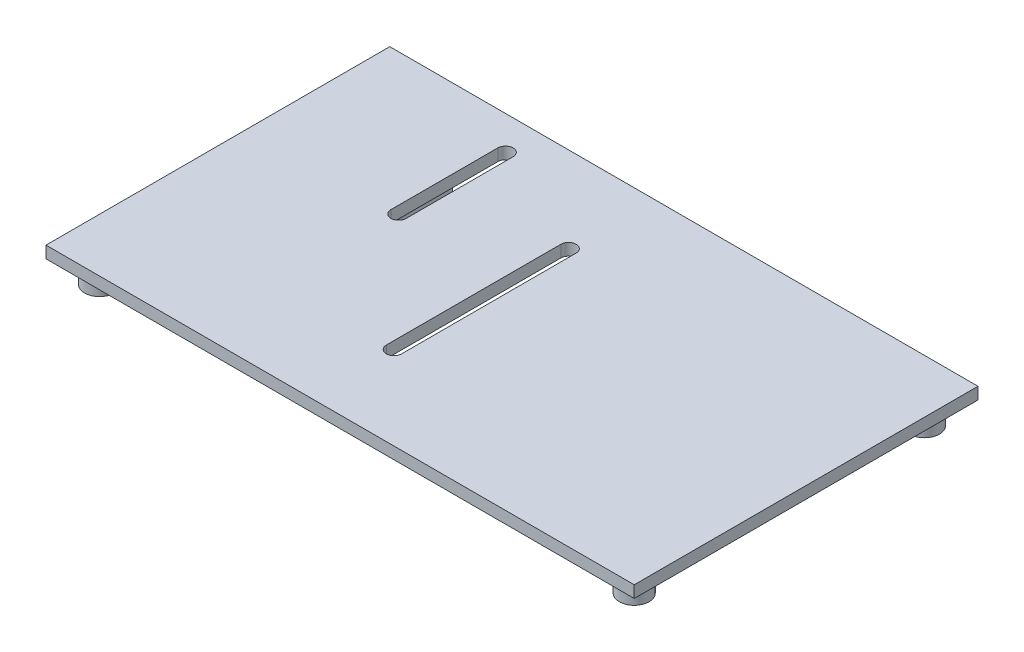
SolidWorks part; units mm, degrees
ref_plane "Front Plane" through (0, 0, 0) normal (0, 0, 1) x (1, 0, 0)
ref_plane "Top Plane" through (0, 0, 0) normal (0, 1, 0) x (1, 0, 0)
ref_plane "Right Plane" through (0, 0, 0) normal (1, 0, 0) x (0, 0, -1)
sketch "Sketch1" plane through (0, 0, 0) normal (0, 1, 0) x (1, 0, 0)
  line L1 (-38.5, -22.5) -> (38.5, -22.5)
  line L2 (-38.5, -22.5) -> (-38.5, 22.5)
  line L3 (-38.5, 22.5) -> (38.5, 22.5)
  line L4 (38.5, -22.5) -> (38.5, 22.5)
  line L5 (-38.5, -22.5) -> (38.5, 22.5) construction
  line L6 (-38.5, 22.5) -> (38.5, -22.5) construction
  point P0 (0, 0)
  dimension "D1" = 77
  dimension "D2" = 45
extrude "Base Extrude" add sketch "Sketch1" along normal blind 1.56
sketch "Sketch2" plane through (0, 0, 0) normal (0, -1, 0) x (1, 0, 0)
  line L1 (-35, 19) -> (35, 19) construction
  line L2 (-35, 19) -> (-35, -19) construction
  line L3 (-35, -19) -> (35, -19) construction
  line L4 (35, 19) -> (35, -19) construction
  line L5 (-35, 19) -> (35, -19) construction
  line L6 (-35, -19) -> (35, 19) construction
  circle A0 centre (-35, 19) radius 3
  circle A1 centre (35, 19) radius 3
  circle A2 centre (-35, -19) radius 3
  circle A3 centre (35, -19) radius 3
  point P8 (0, 0)
  dimension "D3" = 6
  dimension "D1" = 70
  dimension "D2" = 38
extrude "Standoff Extrude" add sketch "Sketch2" along normal blind 0.5
sketch "Sketch3" plane through (0, -0.5, 0) normal (0, -1, 0) x (1, 0, 0)
  circle A0 centre (-35, 19) radius 1.95
  circle A1 centre (-35, -19) radius 1.95
  circle A2 centre (35, -19) radius 1.95
  circle A3 centre (35, 19) radius 1.95
  dimension "D1" = 3.9
extrude "Standoff Extrude Two" add sketch "Sketch3" along normal blind 2.4
sketch "Sketch4" plane through (0, 0, 0) normal (0, -1, 0) x (1, 0, 0)
  line L0 (-38.5, 22.5) -> (38.5, 22.5) construction
  line L1 (-25, 13) -> (-20.3, 13)
  line L2 (-25, 13) -> (-25, -12.5)
  line L3 (-25, -12.5) -> (-20.3, -12.5)
  line L4 (-20.3, 13) -> (-20.3, -12.5)
  line L9 (12.25, -12.6) -> (17, -12.6)
  line L10 (12.25, -12.6) -> (12.25, -19.65)
  line L11 (12.25, -19.65) -> (17, -19.65)
  line L12 (17, -12.6) -> (17, -19.65)
  line L13 (-38.5, -22.5) -> (-38.5, 22.5) construction
  line L14 (38.5, -22.5) -> (-38.5, -22.5) construction
  line L15 (38.5, 22.5) -> (38.5, -22.5) construction
  dimension "D1" = 4.7
  dimension "D2" = 25.5
  dimension "D3" = 9.5
  dimension "D4" = 13.5
  dimension "D5" = 2.85
  dimension "D6" = 21.5
  dimension "D7" = 4.75
  dimension "D8" = 7.05
extrude "Touch and TFT ZIF" add sketch "Sketch4" along normal blind 1.25
sketch "Sketch5" plane through (0, 0, 0) normal (0, -1, 0) x (1, 0, 0)
  line L0 (-38.5, 22.5) -> (38.5, 22.5) construction
  line L1 (24, 9.75) -> (29.5, 9.75)
  line L2 (24, 9.75) -> (24, -9.75)
  line L3 (24, -9.75) -> (29.5, -9.75)
  line L4 (29.5, 9.75) -> (29.5, -9.75)
  line L5 (38.5, 22.5) -> (38.5, -22.5) construction
  dimension "D1" = 5.5
  dimension "D2" = 19.5
  dimension "D3" = 12.75
  dimension "D4" = 9
extrude "Interface ZIF" add sketch "Sketch5" along normal blind 2
sketch "Sketch6" plane through (0, 0, 0) normal (0, -1, 0) x (1, 0, 0)
  line L0 (-18.95, -4.1) -> (-18.95, -18.1) construction
  line L1 (-17.95, -4.1) -> (-17.95, -18.1)
  line L2 (-19.95, -4.1) -> (-19.95, -18.1)
  line L3 (-3.9, 11.55) -> (-3.9, -11.3) construction
  line L4 (-2.9, 11.55) -> (-2.9, -11.3)
  line L5 (-4.9, 11.55) -> (-4.9, -11.3)
  line L6 (-38.5, -22.5) -> (-38.5, 22.5) construction
  line L7 (38.5, -22.5) -> (-38.5, -22.5) construction
  arc A0 (-17.95, -4.1) -> (-19.95, -4.1) centre (-18.95, -4.1) ccw
  arc A1 (-19.95, -18.1) -> (-17.95, -18.1) centre (-18.95, -18.1) ccw
  arc A2 (-2.9, 11.55) -> (-4.9, 11.55) centre (-3.9, 11.55) ccw
  arc A3 (-4.9, -11.3) -> (-2.9, -11.3) centre (-3.9, -11.3) ccw
  point P2 (-18.95, -11.1)
  point P7 (-3.9, 0.125)
  dimension "D3" = 22.85
  dimension "D1" = 2
  dimension "D2" = 2
  dimension "D4" = 14
  dimension "D5" = 18.55
  dimension "D6" = 33.6
  dimension "D7" = 4.4
  dimension "D8" = 11.2
extrude "Cutout Cut" cut sketch "Sketch6" against normal through all
sketch "Sketch13" plane through (0, -2.9, 0) normal (0, -1, 0) x (1, 0, 0)
  circle A0 centre (-35, 19) radius 0.9
  circle A1 centre (35, 19) radius 0.9
  circle A2 centre (35, -19) radius 0.9
  circle A3 centre (-35, -19) radius 0.9
  dimension "D1" = 1.8
hole_wizard "#2-56 Tapped Hole1" positions "Sketch15" profile "Sketch14" tap size "#2-56" standard "ANSI Inch"
sketch "Sketch15" plane through (0, -2.9, 0) normal (0, -1, 0) x (-1, 0, 0)
  point P0 (-35, -19)
  point P3 (-35, 19)
  point P6 (35, 19)
  point P9 (35, -19)
sketch "Sketch14" plane through (35, -2.9, 19) normal (1, 0, 0) x (0, 0, -1)
  line L0 (0, 0) -> (0, 4.0342)
  line L1 (0, 4.0342) -> (0.889, 3.5)
  line L2 (0.889, 3.5) -> (0.889, 0)
  line L5 (0.889, 0) -> (0, 0)
  line L10 (0, 4.0342) -> (-0.889, 3.5) construction
  line L11 (0, -6.35) -> (0, 107.95) construction
  dimension "Tap Drill Dia." = 1.778
  dimension "Tap Drill Depth" = 3.5
  dimension "Drill Angle" = 118
